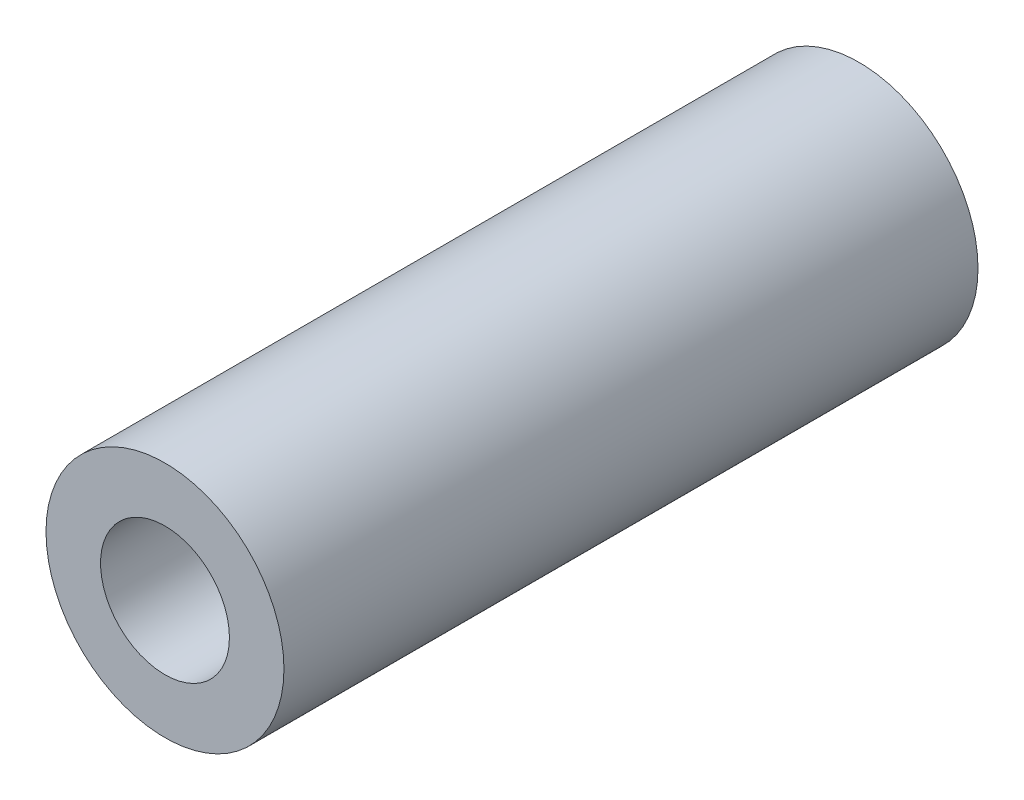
SolidWorks part; units mm, degrees
ref_plane "Plan1" through (0, 0, 0) normal (0, 0, 1) x (1, 0, 0)
ref_plane "Plan2" through (0, 0, 0) normal (0, 1, 0) x (1, 0, 0)
ref_plane "Plan3" through (0, 0, 0) normal (1, 0, 0) x (0, 0, -1)
sketch "Esquisse1" plane through (0, 0, 0) normal (0, 0, 1) x (1, 0, 0)
  circle A0 centre (0, 0) radius 6
  circle A1 centre (0, 0) radius 3.25
  dimension "D1" = 6.5
  dimension "D2" = 12
extrude "Base-Extrusion" add sketch "Esquisse1" along normal blind 35
